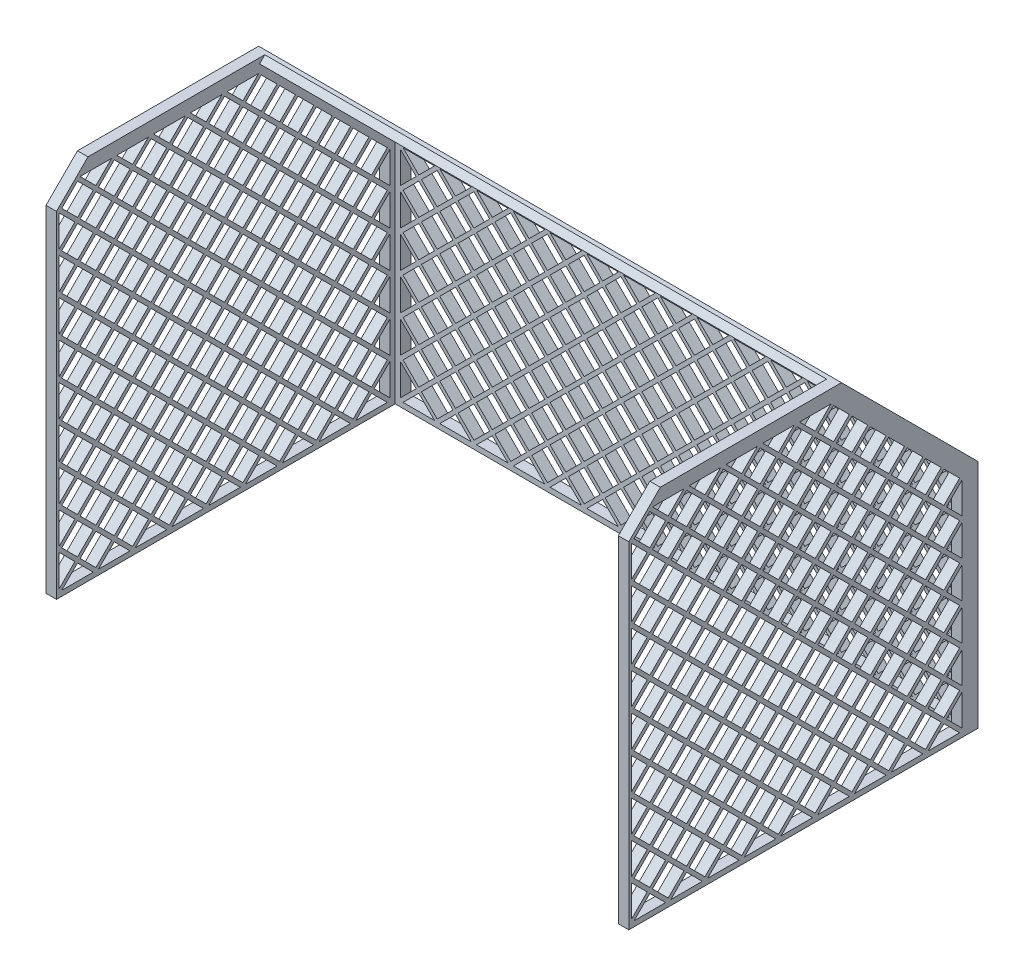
SolidWorks part; units mm, degrees
ref_plane "Plan de face" through (0, 0, 0) normal (0, 0, 1) x (1, 0, 0)
ref_plane "Plan de dessus" through (0, 0, 0) normal (0, 1, 0) x (1, 0, 0)
ref_plane "Plan de droite" through (0, 0, 0) normal (1, 0, 0) x (0, 0, -1)
sketch "Esquisse1" plane through (0, 0, 0) normal (0, 1, 0) x (1, 0, 0)
  line L0 (-55.5, -66.5) -> (-53.5, -66.5)
  line L2 (-55.5, -66.5) -> (-55.5, 0)
  line L3 (-55.5, 0) -> (55.5, 0)
  line L4 (55.5, -66.5) -> (55.5, 0)
  line L5 (-53.5, -66.5) -> (-53.5, -2)
  line L6 (-53.5, -2) -> (53.5, -2)
  line L7 (53.5, -2) -> (53.5, -66.5)
  line L8 (53.5, -66.5) -> (55.5, -66.5)
  point P4 (0, 0)
  dimension "D1" = 111
  dimension "D2" = 66.5
  dimension "D3" = 2
  dimension "D4" = 2
extrude "Boss.-Extru.1" add sketch "Esquisse1" along normal blind 44
sketch "Esquisse2" plane through (55.5, 0, 0) normal (1, 0, 0) x (0, 0, -1)
  line L0 (-66.5, 44) -> (-66.5, 70)
  line L1 (-66.5, 70) -> (-28, 70)
  line L2 (-28, 70) -> (-2, 44)
  line L3 (-2, 44) -> (-66.5, 44)
  line L4 (-66.5, 44) -> (0, 44) construction
  dimension "D1" = 45
  dimension "D2" = 38.5
extrude "Boss.-Extru.2" add sketch "Esquisse2" against normal up to surface (2 mm away)
sketch "Esquisse3" plane through (-55.5, 0, 0) normal (-1, 0, 0) x (0, 0, 1)
  line L0 (2, 44) -> (28, 70)
  line L1 (28, 70) -> (66.5, 70)
  line L2 (66.5, 70) -> (66.5, 44)
  line L3 (66.5, 44) -> (2, 44)
extrude "Boss.-Extru.3" add sketch "Esquisse3" against normal up to surface (2 mm away)
sketch "Esquisse5" plane through (-55.5, 0, 0) normal (-1, 0, 0) x (0, 0, 1)
  line L0 (0, 44) -> (26, 70)
  line L1 (26, 70) -> (28.8284, 70)
  line L2 (28.8284, 70) -> (2.8284, 44)
  line L3 (2.8284, 44) -> (0, 44)
  line L4 (28, 70) -> (2, 44) construction
  line L5 (66.5, 70) -> (28, 70) construction
  dimension "D1" = 2
extrude "Boss.-Extru.4" add sketch "Esquisse5" against normal up to surface (111 mm away)
sketch "Esquisse6" plane through (53.5, 0, 0) normal (-1, 0, 0) x (0, 0, 1)
  line L0 (2.8284, 44) -> (2, 43.1716)
  line L1 (2, 44) -> (2, 0) construction
  line L2 (2, 43.1716) -> (2, 44)
  line L3 (2, 44) -> (2.8284, 44)
  line L4 (2.8284, 44) -> (28.8284, 70) construction
extrude "Boss.-Extru.5" add sketch "Esquisse6" along normal up to surface (107 mm away)
sketch "Esquisse8" plane through (0, 0, 0) normal (0, 0, -1) x (-1, 0, 0)
  line L0 (-52, 1) -> (-46, 1)
  line L1 (-46, 1) -> (-49, 4)
  line L2 (-49, 4) -> (-52, 1)
  line L5 (-53.5, 43.1716) -> (-53.5, 0) construction
  line L16 (-55.5, 0) -> (55.5, 0) construction
  dimension "D1" = 3
  dimension "D2" = 1
  dimension "D3" = 45
  dimension "D4" = 1.5
extrude "Enlèv. mat.-Extru.1" cut sketch "Esquisse8" against normal through all
pattern_linear "Répétition linéaire1" count 15 spacing 7 along (-1, 0, 0) of "Enlèv. mat.-Extru.1"
sketch "Esquisse9" plane through (0, 0, 0) normal (0, 0, -1) x (-1, 0, 0)
  line L0 (-52.5, 1.5) -> (-49.5, 4.5)
  line L1 (-49.5, 4.5) -> (-52.5, 7.5)
  line L2 (-52.5, 7.5) -> (-52.5, 1.5)
  line L3 (-53.5, 43.1716) -> (-53.5, 0) construction
  line L4 (-49, 4) -> (-52, 1) construction
  line L5 (-46, 1) -> (-49, 4) construction
  line L6 (52.5, 1.5) -> (52.5, 7.5)
  line L7 (52.5, 7.5) -> (49.5, 4.5)
  line L8 (49.5, 4.5) -> (52.5, 1.5)
  line L9 (52, 1) -> (49, 4) construction
  line L10 (53.5, 43.1716) -> (53.5, 0) construction
  line L11 (49, 4) -> (46, 1) construction
  dimension "D1" = 1
  dimension "D2" = 3
  dimension "D3" = 1
  dimension "D4" = 3
extrude "Enlèv. mat.-Extru.2" cut sketch "Esquisse9" against normal through all
pattern_linear "Répétition linéaire2" count 6 spacing 7 along (0, 1, 0) of "Enlèv. mat.-Extru.2"
sketch "Esquisse10" plane through (0, 0, 0) normal (0, 0, -1) x (-1, 0, 0)
  line L0 (-52, 43) -> (-46, 43)
  line L1 (-46, 43) -> (-49, 40)
  line L2 (-49, 40) -> (-52, 43)
  line L3 (-52.5, 36.5) -> (-49.5, 39.5) construction
  dimension "D1" = 3
extrude "Enlèv. mat.-Extru.3" cut sketch "Esquisse10" against normal through all
sketch "Esquisse11" plane through (0, 0, 0) normal (0, 0, -1) x (-1, 0, 0)
  line L0 (-48.5, 4.5) -> (-45.5, 1.5)
  line L1 (-45.5, 1.5) -> (-42.5, 4.5)
  line L2 (-42.5, 4.5) -> (-45.5, 7.5)
  line L3 (-45.5, 7.5) -> (-48.5, 4.5)
  line L4 (-49, 4) -> (-52, 1) construction
  line L5 (-39, 1) -> (-42, 4) construction
  dimension "D1" = 6
extrude "Enlèv. mat.-Extru.4" cut sketch "Esquisse11" against normal through all
pattern_linear "Répétition linéaire4" count 14 spacing 7 along (-1, 0, 0) of "Enlèv. mat.-Extru.4"
pattern_linear "Répétition linéaire6" count 15 spacing 7 along (-1, 0, 0) of "Enlèv. mat.-Extru.3"
pattern_linear "Répétition linéaire7" count 6 spacing 7 along (0, 1, 0) of "Répétition linéaire4", "Enlèv. mat.-Extru.4"
sketch "Esquisse13" plane through (0, 0, 0) normal (0, 0, -1) x (-1, 0, 0)
  line L0 (-52, 8) -> (-49, 11)
  line L1 (-49, 11) -> (-46, 8)
  line L2 (-46, 8) -> (-49, 5)
  line L3 (-49, 5) -> (-52, 8)
  line L4 (-52.5, 1.5) -> (-49.5, 4.5) construction
  line L5 (-48.5, 4.5) -> (-45.5, 1.5) construction
  line L6 (-45.5, 14.5) -> (-48.5, 11.5) construction
  line L7 (-42.5, 4.5) -> (-45.5, 7.5) construction
extrude "Enlèv. mat.-Extru.5" cut sketch "Esquisse13" against normal through all
pattern_linear "Répétition linéaire8" count 15 spacing 7 along (-1, 0, 0) of "Enlèv. mat.-Extru.5"
pattern_linear "Répétition linéaire9" count 5 spacing 7 along (0, 1, 0) of "Répétition linéaire8", "Enlèv. mat.-Extru.5"
sketch "Esquisse14" plane through (0, 22, -22) normal (0, 0.7071, -0.7071) x (1, 0, 0)
  line L0 (52, -32.1127) -> (46, -32.1127)
  line L1 (46, -32.1127) -> (49, -35.1127)
  line L2 (49, -35.1127) -> (52, -32.1127)
  line L3 (53.5, -69.8823) -> (53.5, -31.9411) construction
  line L5 (55.5, -31.1127) -> (-55.5, -31.1127) construction
  dimension "D1" = 1.5
  dimension "D2" = 1
  dimension "D3" = 3
  dimension "D4" = 45
extrude "Enlèv. mat.-Extru.6" cut sketch "Esquisse14" against normal through all
pattern_linear "Répétition linéaire10" count 15 spacing 7 along (-1, 0, 0) of "Enlèv. mat.-Extru.6"
sketch "Esquisse15" plane through (0, 22, -22) normal (0, 0.7071, -0.7071) x (1, 0, 0)
  line L0 (52.5, -32.6127) -> (52.5, -38.6127)
  line L1 (52.5, -38.6127) -> (49.5, -35.6127)
  line L2 (49.5, -35.6127) -> (52.5, -32.6127)
  line L3 (53.5, -69.8823) -> (53.5, -31.9411) construction
  line L4 (46, -32.1127) -> (49, -35.1127) construction
  dimension "D1" = 1
  dimension "D2" = 3
extrude "Enlèv. mat.-Extru.7" cut sketch "Esquisse15" against normal through all
pattern_linear "Répétition linéaire11" count 5 spacing 7 along (0, 0.7071, 0.7071) of "Enlèv. mat.-Extru.7"
sketch "Esquisse16" plane through (0, 22, -22) normal (0, 0.7071, -0.7071) x (1, 0, 0)
  line L0 (52, -67.1127) -> (46, -67.1127)
  line L1 (46, -67.1127) -> (49, -64.1127)
  line L2 (49, -64.1127) -> (52, -67.1127)
  line L3 (52.5, -60.6127) -> (49.5, -63.6127) construction
  dimension "D1" = 3
extrude "Enlèv. mat.-Extru.8" cut sketch "Esquisse16" against normal through all
pattern_linear "Répétition linéaire12" count 15 spacing 7 along (-1, 0, 0) of "Enlèv. mat.-Extru.8"
sketch "Esquisse17" plane through (0, 22, -22) normal (0, 0.7071, -0.7071) x (1, 0, 0)
  line L0 (-52.5, -32.6127) -> (-52.5, -38.6127)
  line L1 (-52.5, -38.6127) -> (-49.5, -35.6127)
  line L2 (-49.5, -35.6127) -> (-52.5, -32.6127)
  line L5 (-53.5, -31.9411) -> (-53.5, -69.8823) construction
  line L6 (-49, -35.1127) -> (-46, -32.1127) construction
  dimension "D1" = 3
  dimension "D2" = 1
extrude "Enlèv. mat.-Extru.9" cut sketch "Esquisse17" against normal through all
pattern_linear "Répétition linéaire13" count 5 spacing 7 along (0, 0.7071, 0.7071) of "Enlèv. mat.-Extru.9"
sketch "Esquisse18" plane through (0, 22, -22) normal (0, 0.7071, -0.7071) x (1, 0, 0)
  line L0 (45.5, -32.6127) -> (42.5, -35.6127)
  line L1 (42.5, -35.6127) -> (45.5, -38.6127)
  line L2 (45.5, -38.6127) -> (48.5, -35.6127)
  line L3 (48.5, -35.6127) -> (45.5, -32.6127)
  line L4 (39, -32.1127) -> (42, -35.1127) construction
  line L5 (49, -35.1127) -> (52, -32.1127) construction
  dimension "D1" = 6
extrude "Enlèv. mat.-Extru.10" cut sketch "Esquisse18" against normal through all
pattern_linear "Répétition linéaire14" count 14 spacing 7 along (-1, 0, 0) of "Enlèv. mat.-Extru.10"
pattern_linear "Répétition linéaire15" count 5 spacing 7 along (0, 0.7071, 0.7071) of "Répétition linéaire14", "Enlèv. mat.-Extru.10"
sketch "Esquisse19" plane through (0, 22, -22) normal (0, 0.7071, -0.7071) x (1, 0, 0)
  line L0 (49, -36.1127) -> (46, -39.1127)
  line L1 (46, -39.1127) -> (49, -42.1127)
  line L2 (49, -42.1127) -> (52, -39.1127)
  line L3 (52, -39.1127) -> (49, -36.1127)
  line L4 (42.5, -35.6127) -> (45.5, -38.6127) construction
  line L5 (45.5, -45.6127) -> (48.5, -42.6127) construction
  line L6 (48.5, -35.6127) -> (45.5, -32.6127) construction
  line L7 (52.5, -32.6127) -> (49.5, -35.6127) construction
extrude "Enlèv. mat.-Extru.11" cut sketch "Esquisse19" against normal through all
pattern_linear "Répétition linéaire16" count 15 spacing 7 along (-1, 0, 0) of "Enlèv. mat.-Extru.11"
pattern_linear "Répétition linéaire17" count 4 spacing 7 along (0, 0.7071, 0.7071) of "Répétition linéaire16", "Enlèv. mat.-Extru.11"
sketch "Esquisse20" plane through (55.5, 0, 0) normal (1, 0, 0) x (0, 0, -1)
  line L0 (-3.5, 1) -> (-9.5, 1)
  line L1 (-9.5, 1) -> (-6.5, 4)
  line L2 (-6.5, 4) -> (-3.5, 1)
  line L3 (-2, 43.1716) -> (-2, 0) construction
  line L4 (-66.5, 0) -> (0, 0) construction
  dimension "D1" = 1.5
  dimension "D2" = 1
  dimension "D3" = 3
  dimension "D4" = 45
extrude "Enlèv. mat.-Extru.12" cut sketch "Esquisse20" against normal through all
pattern_linear "Répétition linéaire18" count 10 spacing 7 along (0, 0, 1) of "Enlèv. mat.-Extru.12"
sketch "Esquisse21" plane through (55.5, 0, 0) normal (1, 0, 0) x (0, 0, -1)
  line L0 (-3, 1.5) -> (-3, 7.5)
  line L1 (-3, 7.5) -> (-6, 4.5)
  line L2 (-6, 4.5) -> (-3, 1.5)
  line L3 (-2, 43.1716) -> (-2, 0) construction
  line L4 (-6.5, 4) -> (-9.5, 1) construction
  dimension "D1" = 1
  dimension "D2" = 3
extrude "Enlèv. mat.-Extru.13" cut sketch "Esquisse21" against normal through all
pattern_linear "Répétition linéaire19" count 6 spacing 7 of "Enlèv. mat.-Extru.13"
sketch "Esquisse22" plane through (55.5, 0, 0) normal (1, 0, 0) x (0, 0, -1)
  line L0 (-66, 1.5) -> (-66, 7.5)
  line L1 (-66, 7.5) -> (-63, 4.5)
  line L2 (-63, 4.5) -> (-66, 1.5)
  line L5 (-59.5, 1) -> (-62.5, 4) construction
  dimension "D1" = 3
  dimension "D2" = 0.5
extrude "Enlèv. mat.-Extru.14" cut sketch "Esquisse22" against normal through all
pattern_linear "Répétition linéaire20" count 9 spacing 7 of "Enlèv. mat.-Extru.14"
sketch "Esquisse24" plane through (55.5, 0, 0) normal (1, 0, 0) x (0, 0, -1)
  line L0 (-65.5, 8) -> (-62.5, 11)
  line L1 (-62.5, 11) -> (-59.5, 8)
  line L2 (-59.5, 8) -> (-62.5, 5)
  line L3 (-62.5, 5) -> (-65.5, 8)
  line L4 (-66, 1.5) -> (-63, 4.5) construction
  line L5 (-63, 11.5) -> (-66, 14.5) construction
  dimension "D1" = 6
extrude "Enlèv. mat.-Extru.16" cut sketch "Esquisse24" against normal through all
pattern_linear "Répétition linéaire22" count 9 spacing 7 along (0, 1, 0) of "Enlèv. mat.-Extru.16"
pattern_linear "Répétition linéaire23" count 6 spacing 7 along (0, 0, -1) of "Répétition linéaire22", "Enlèv. mat.-Extru.16"
pattern_linear "Répétition linéaire24" count 4 spacing 7 along (0, 0, -1) of "Répétition linéaire23"
pattern_linear "Répétition linéaire27" count 3 spacing 7 along (0, 0, -1) of "Répétition linéaire23"
pattern_linear "Répétition linéaire28" count 2 spacing 7 of "Répétition linéaire23"
sketch "Esquisse25" plane through (55.5, 0, 0) normal (1, 0, 0) x (0, 0, -1)
  line L0 (-10, 7.5) -> (-13, 4.5)
  line L1 (-13, 4.5) -> (-10, 1.5)
  line L2 (-10, 1.5) -> (-7, 4.5)
  line L3 (-7, 4.5) -> (-10, 7.5)
  line L4 (-3.5, 1) -> (-6.5, 4) construction
  line L5 (-13.5, 4) -> (-16.5, 1) construction
  line L6 (-6.5, 5) -> (-3.5, 8) construction
  line L7 (-16.5, 8) -> (-13.5, 5) construction
extrude "Enlèv. mat.-Extru.17" cut sketch "Esquisse25" against normal through all
pattern_linear "Répétition linéaire29" count 8 spacing 7 along (0, 0, 1) of "Enlèv. mat.-Extru.17"
pattern_linear "Répétition linéaire30" count 7 spacing 7 along (0, 1, 0) of "Répétition linéaire29", "Enlèv. mat.-Extru.17"
pattern_linear "Répétition linéaire31" count 3 spacing 7 along (0, 1, 0) of "Répétition linéaire30"
pattern_linear "Répétition linéaire33" count 6 spacing 7 along (0, 0, -1) of "Répétition linéaire31"
pattern_linear "Répétition linéaire34" count 2 spacing 7 of "Répétition linéaire33"
sketch "Esquisse26" plane through (55.5, 0, 0) normal (1, 0, 0) x (0, 0, -1)
  line L0 (-28, 67.5) -> (-34, 67.5)
  line L1 (-34, 67.5) -> (-31, 64.5)
  line L2 (-31, 64.5) -> (-28, 67.5)
  line L3 (-34.5, 61) -> (-31.5, 64) construction
  line L4 (-30.5, 64) -> (-27.5, 61) construction
  dimension "D1" = 3
extrude "Enlèv. mat.-Extru.18" cut sketch "Esquisse26" against normal through all
pattern_linear "Répétition linéaire35" count 5 spacing 7 along (0, 0, 1) of "Enlèv. mat.-Extru.18"
chamfer "Chanfrein1" distance 6 angle 45
chamfer "Chanfrein2" distance 2 angle 45
